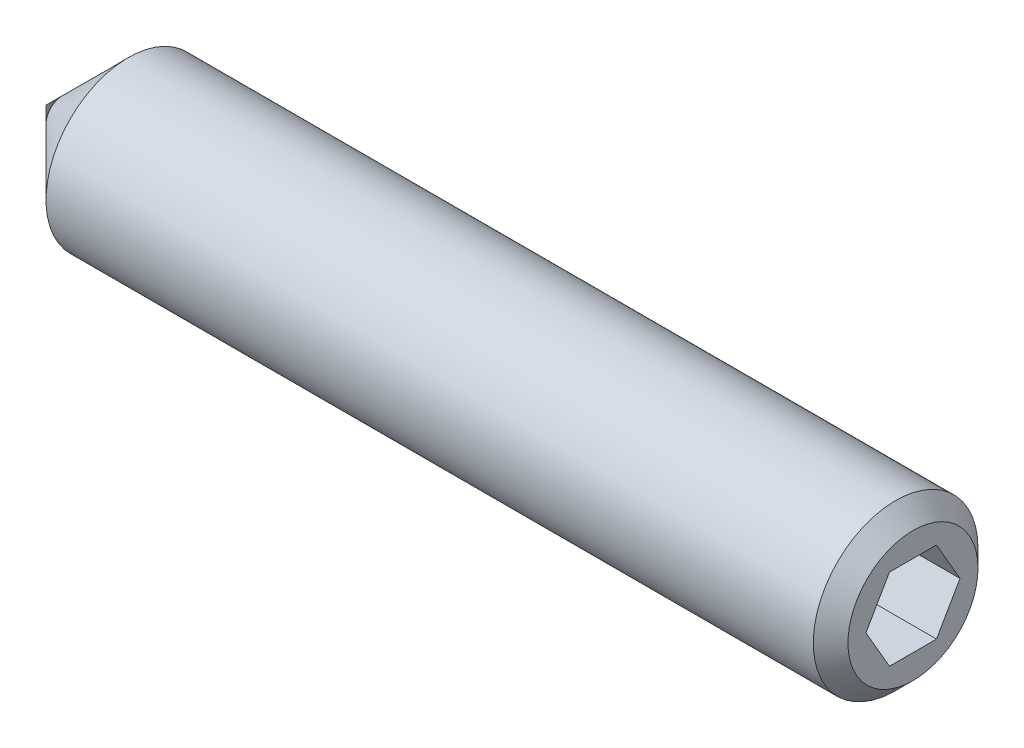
SolidWorks part; units mm, degrees
ref_plane "Plane1" through (0, 0, 0) normal (0, 0, 1) x (1, 0, 0)
ref_plane "Plane2" through (0, 0, 0) normal (0, 1, 0) x (1, 0, 0)
ref_plane "Plane3" through (0, 0, 0) normal (1, 0, 0) x (0, 0, -1)
sketch "Sketch1" plane through (0, 0, 0) normal (0, 0, 1) x (1, 0, 0)
  line L0 (0, 0) -> (2.413, 2.413)
  line L1 (2.413, 2.413) -> (25.4, 2.413)
  line L2 (25.4, 2.413) -> (25.4, 0)
  line L3 (25.4, 0) -> (0, 0)
  line L4 (0, 0) -> (-6.8738, 0) construction
  dimension "D1" = 2.413
  dimension "D2" = 45
  dimension "D3" = 25.4
revolve "Base" add sketch "Sketch1" angle 360 about L4
chamfer "Chamfer1" distance 0.508 angle 45
sketch "Hexagon - circumscribed1" plane through (25.4, -0.6013, -0.5032) normal (1, 0, 0) x (0, 0, -1)
  line L0 (-1.1924, 1.7951) -> (0.1861, 1.7951)
  line L1 (0.1861, 1.7951) -> (0.8753, 0.6013)
  line L2 (0.8753, 0.6013) -> (0.1861, -0.5925)
  line L3 (0.1861, -0.5925) -> (-1.1924, -0.5925)
  line L4 (-1.1924, -0.5925) -> (-1.8816, 0.6013)
  line L5 (-1.8816, 0.6013) -> (-1.1924, 1.7951)
  circle A0 centre (-0.5032, 0.6013) radius 1.1938 construction
  dimension "D1" = 2.3876
extrude "Cut-Extrude1" cut sketch "Hexagon - circumscribed1" against normal blind 3.048
